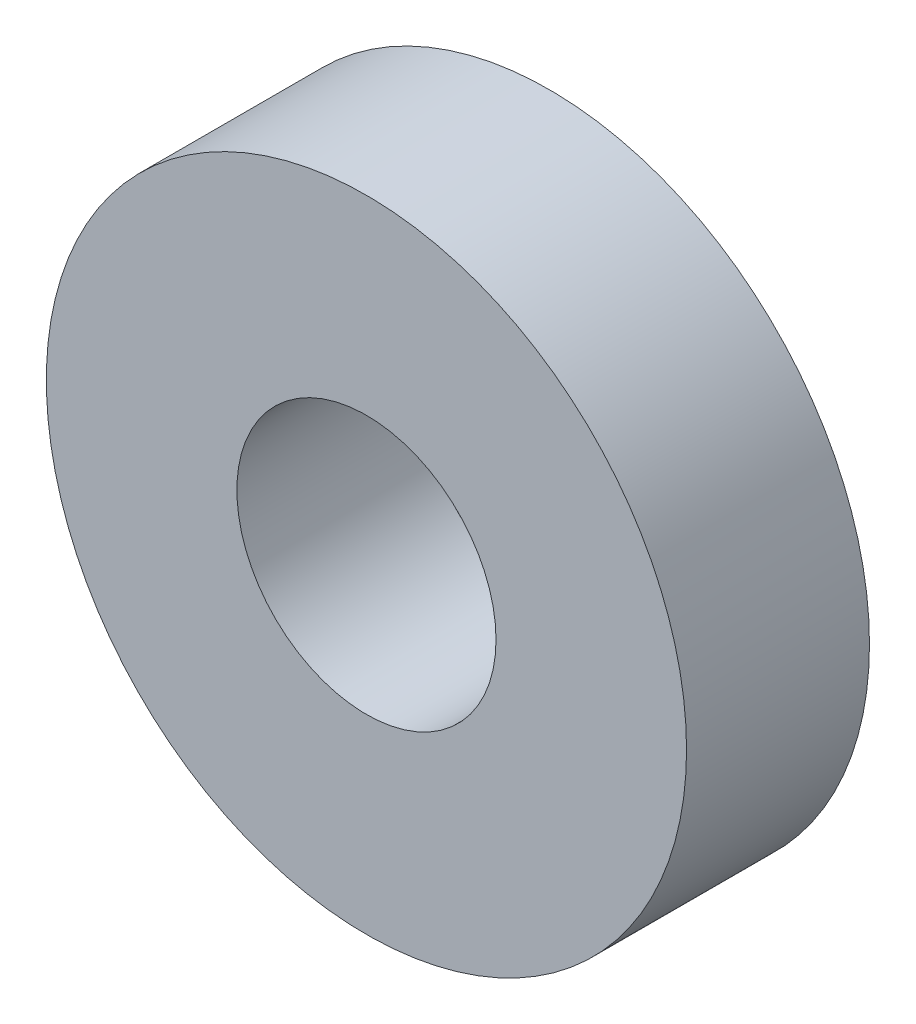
SolidWorks part; units mm, degrees
ref_plane "Front Plane" through (0, 0, 0) normal (0, 0, 1) x (1, 0, 0)
ref_plane "Top Plane" through (0, 0, 0) normal (0, 1, 0) x (1, 0, 0)
ref_plane "Right Plane" through (0, 0, 0) normal (1, 0, 0) x (0, 0, -1)
sketch "Sketch1" plane through (0, 0, 0) normal (0, 0, 1) x (1, 0, 0)
  circle A0 centre (0, 0) radius 21
  circle A1 centre (0, 0) radius 8.5
  dimension "D1" = 42
  dimension "D2" = 17
extrude "Boss-Extrude1" add sketch "Sketch1" along normal blind 12
